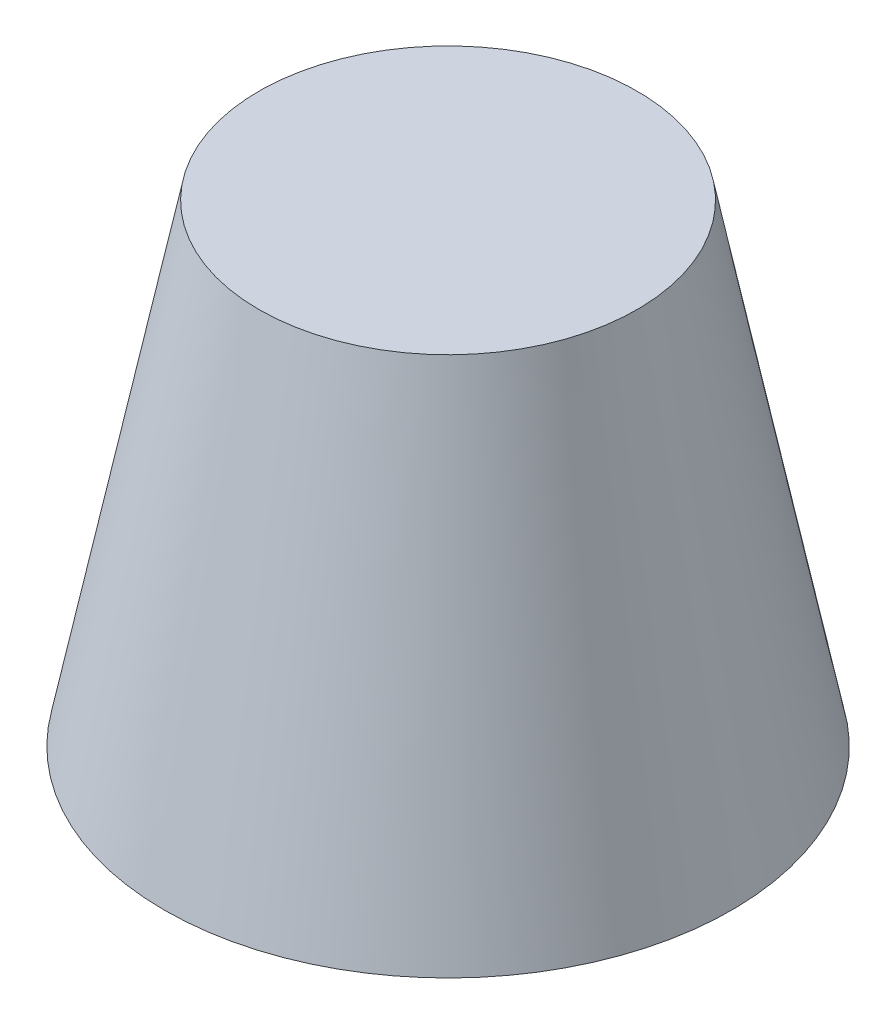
SolidWorks part; units mm, degrees
ref_plane "frontal" through (0, 0, 0) normal (0, 0, 1) x (1, 0, 0)
ref_plane "horizontal" through (0, 0, 0) normal (0, 1, 0) x (1, 0, 0)
ref_plane "profil" through (0, 0, 0) normal (1, 0, 0) x (0, 0, -1)
sketch "Esquisse1" plane through (0, 0, 0) normal (0, 0, 1) x (1, 0, 0)
  line L0 (0, 24) -> (0, -6) construction
  line L1 (0, 0) -> (6, 0)
  line L2 (6, 0) -> (4, 10)
  line L3 (4, 10) -> (0, 10)
  line L4 (0, 0) -> (0, 10)
  dimension "D1" = 10
  dimension "D2" = 4
  dimension "D3" = 6
revolve "  " add sketch "Esquisse1" angle 360 about L0
